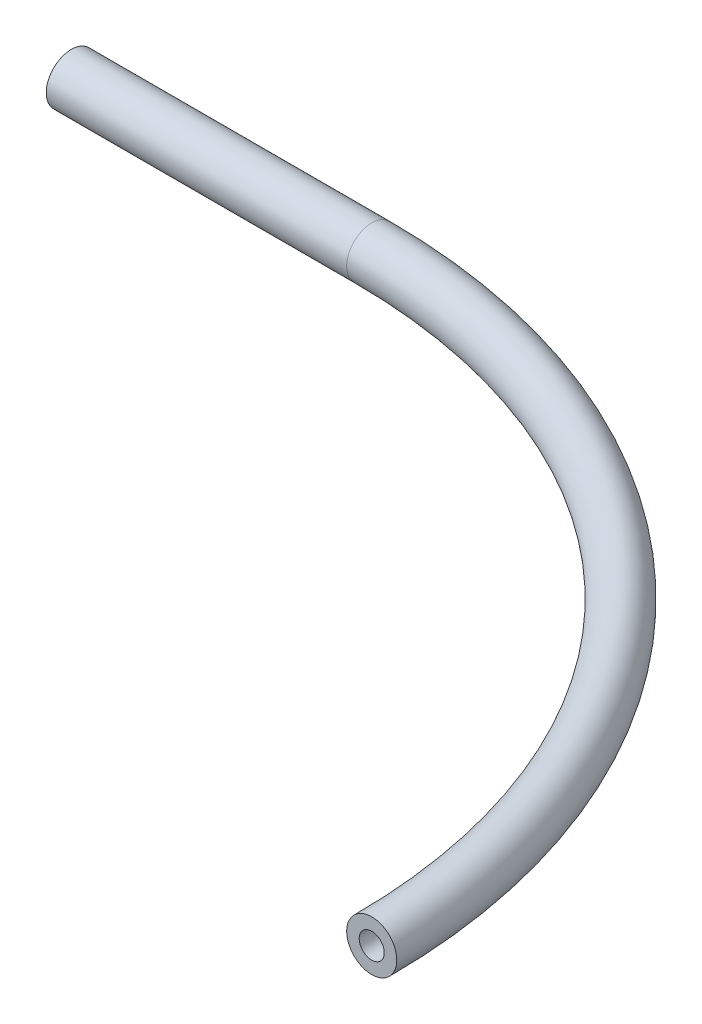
SolidWorks part; units mm, degrees
ref_plane "Front Plane" through (0, 0, 0) normal (0, 0, 1) x (1, 0, 0)
ref_plane "Top Plane" through (0, 0, 0) normal (0, 1, 0) x (1, 0, 0)
ref_plane "Right Plane" through (0, 0, 0) normal (1, 0, 0) x (0, 0, -1)
sketch "Sketch1" plane through (0, 0, 0) normal (0, 1, 0) x (1, 0, 0)
  line L0 (0, 0) -> (19.05, 0)
  line L1 (57.15, -38.1) -> (19.05, -38.1) construction
  line L2 (19.05, -38.1) -> (19.05, 0) construction
  arc A0 (19.05, 0) -> (57.15, -38.1) centre (19.05, -38.1) cw
  dimension "D1" = 38.1
  dimension "D2" = 19.05
sketch "Sketch2" plane through (0, 0, 0) normal (1, 0, 0) x (0, 0, -1)
  circle A0 centre (0, 0) radius 1.5875
  circle A1 centre (0, 0) radius 0.7937
  dimension "D1" = 3.175
  dimension "D2" = 1.5875
sweep "Sweep1" add profiles "Sketch2" path "Sketch1"
